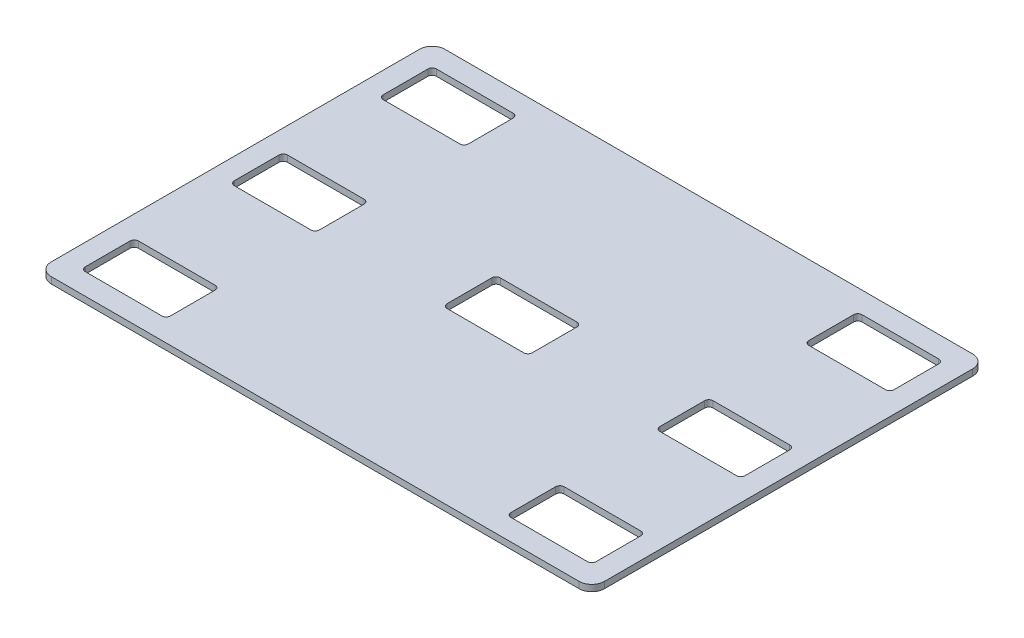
SolidWorks part; units mm, degrees
ref_plane "Front" through (0, 0, 0) normal (0, 0, 1) x (1, 0, 0)
ref_plane "Top" through (0, 0, 0) normal (0, 1, 0) x (1, 0, 0)
ref_plane "Right" through (0, 0, 0) normal (1, 0, 0) x (0, 0, -1)
sketch "Sketch1" plane through (0, 0, 0) normal (0, 1, 0) x (1, 0, 0)
  line L1 (0, 0) -> (260, 0)
  line L2 (0, 0) -> (0, 185)
  line L3 (0, 185) -> (260, 185)
  line L4 (260, 0) -> (260, 185)
  dimension "D1" = 260
  dimension "D2" = 185
extrude "Extrude1" add sketch "Sketch1" along normal blind 3
fillet "Fillet3" radius 6 4 edges at (0, 1.5, -185) (260, 1.5, -185) (260, 1.5, 0) (0, 1.5, 0)
sketch "Sketch2" plane through (0, 3, 0) normal (0, 1, 0) x (-1, 0, 0)
  line L0 (0, -179) -> (0, -6) construction
  line L1 (-10, -10) -> (-50, -10)
  line L2 (-10, -10) -> (-10, -35)
  line L3 (-10, -35) -> (-50, -35)
  line L4 (-50, -10) -> (-50, -35)
  line L5 (-6, 0) -> (-254, 0) construction
  dimension "D1" = 10
  dimension "D2" = 10
  dimension "D3" = 40
  dimension "D4" = 25
extrude "Cut-Extrude1" cut sketch "Sketch2" against normal through all
fillet "Fillet1" radius 2 4 edges at (50, 1.5, -35) (50, 1.5, -10) (10, 1.5, -10) (10, 1.5, -35)
pattern_linear "LPattern1" count 3 spacing 70 along (0, 0, -1) count 3 spacing 100 along (1, 0, 0) of "Cut-Extrude1", "Fillet1"
